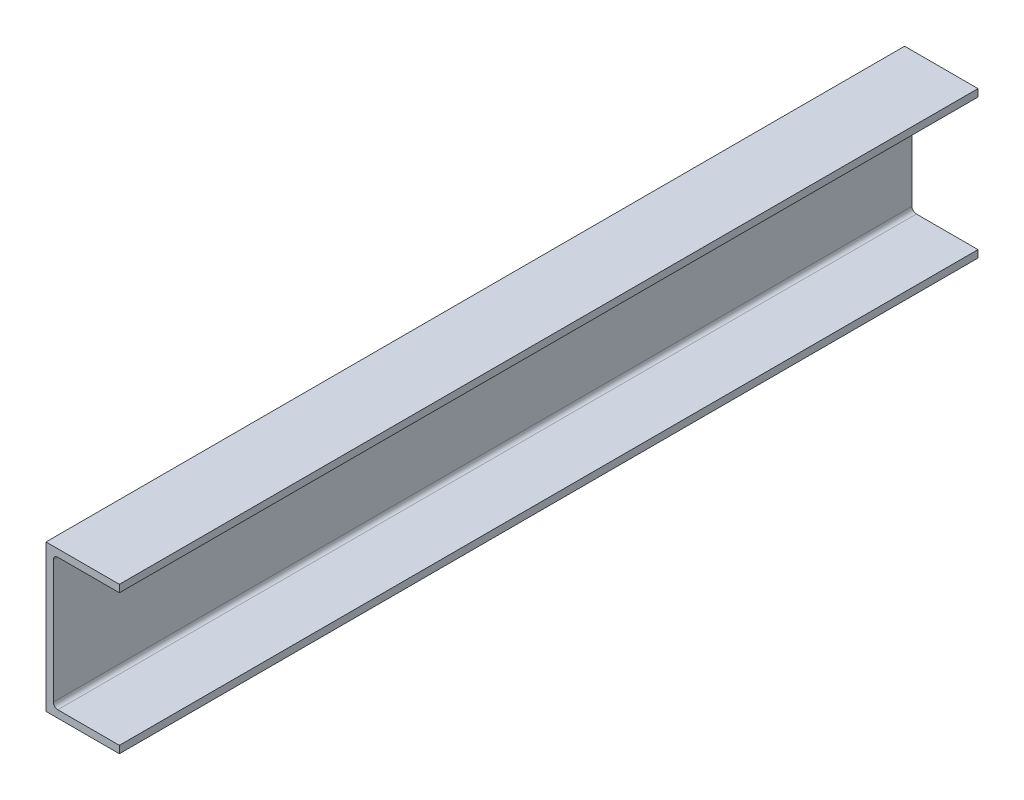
SolidWorks part; units mm, degrees
ref_plane "前视基准面" through (0, 0, 0) normal (0, 0, 1) x (1, 0, 0)
ref_plane "上视基准面" through (0, 0, 0) normal (0, 1, 0) x (1, 0, 0)
ref_plane "右视基准面" through (0, 0, 0) normal (1, 0, 0) x (0, 0, -1)
sketch "草图1" plane through (0, 0, 0) normal (0, 0, 1) x (1, 0, 0)
  line L0 (0, 0) -> (50, 0)
  line L1 (0, 0) -> (0, -100)
  line L2 (0, -100) -> (50, -100)
  line L3 (50, -100) -> (50, -95)
  line L4 (50, -95) -> (8, -95)
  line L5 (5, -92) -> (5, -8)
  line L6 (8, -5) -> (50, -5)
  line L7 (50, 0) -> (50, -5)
  arc A0 (5, -92) -> (8, -95) centre (8, -92) ccw
  arc A2 (8, -5) -> (5, -8) centre (8, -8) ccw
  arc A3 (8, -5) -> (5, -8) centre (8, -8) ccw
  arc A4 (8, -5) -> (5, -8) centre (8, -8) ccw
  dimension "D1" = 3
  dimension "D2" = 3
  dimension "D3" = 3
  dimension "D4" = 3
extrude "凸台-拉伸2" add sketch "草图1" along normal blind 585 contours A2 L6 L7 L0 L1 L2 L3 L4 A0 L5
